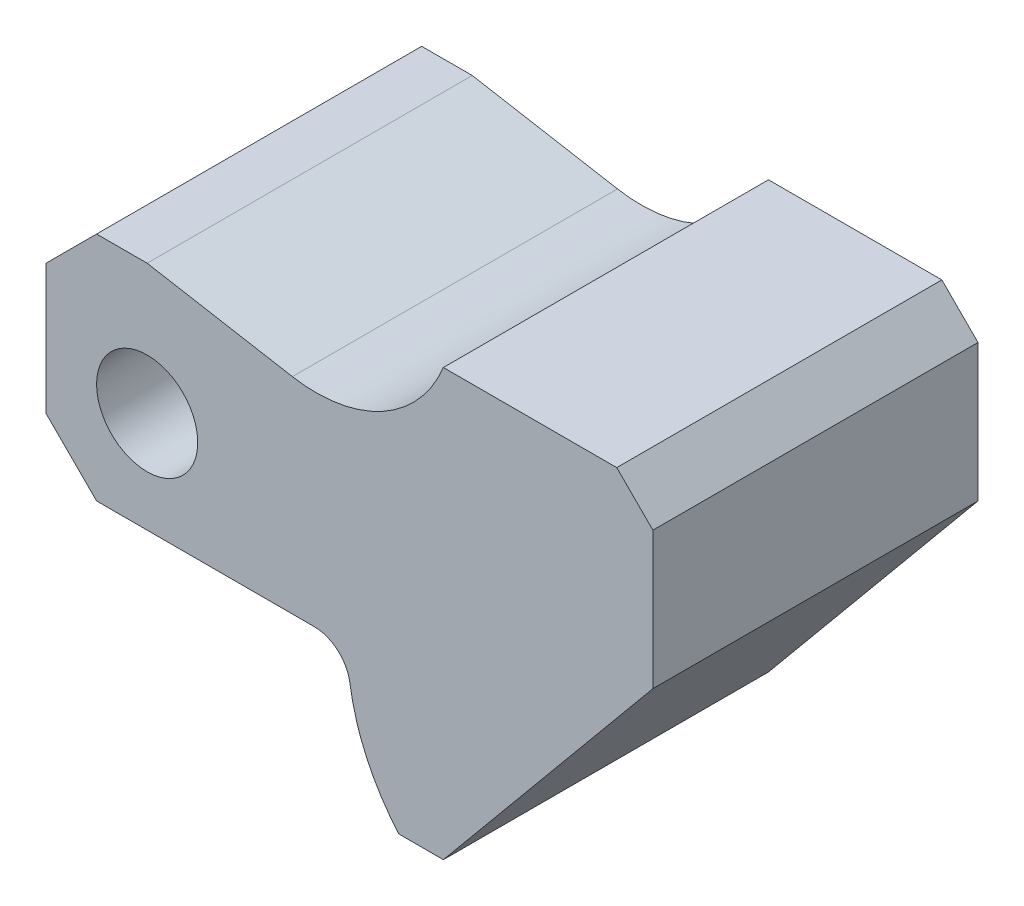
SolidWorks part; units mm, degrees
ref_plane "Front Plane" through (0, 0, 0) normal (0, 0, 1) x (1, 0, 0)
ref_plane "Top Plane" through (0, 0, 0) normal (0, 1, 0) x (1, 0, 0)
ref_plane "Right Plane" through (0, 0, 0) normal (1, 0, 0) x (0, 0, -1)
sketch "Esquisse1" plane through (0, 0, 0) normal (0, 0, 1) x (1, 0, 0)
  line L0 (-8.8823, 17.6898) -> (15.1177, 17.6898)
  line L1 (15.1177, 17.6898) -> (20.1177, 12.6898)
  line L2 (20.1177, 12.6898) -> (20.1177, -6.3102)
  line L3 (20.1177, -6.3102) -> (-8.8823, -41.3102)
  line L4 (-8.8823, -41.3102) -> (-15.0484, -41.3102)
  line L5 (-26.7698, -22.3102) -> (-56.8823, -22.3102)
  line L6 (-56.8823, -22.3102) -> (-63.8823, -15.3102)
  line L7 (-63.8823, -15.3102) -> (-63.8823, 2.6898)
  line L8 (-63.8823, 2.6898) -> (-56.8823, 9.6898)
  line L9 (-56.8823, 9.6898) -> (-49.8823, 9.6898)
  line L10 (-49.8823, 9.6898) -> (-29.7783, 6.1449)
  arc A0 (-15.0484, -41.3102) -> (-21.8242, -26.5749) centre (6.8605, -22.3102) cw
  arc A1 (-21.8242, -26.5749) -> (-26.7698, -22.3102) centre (-26.7698, -27.3102) ccw
  arc A2 (-29.7783, 6.1449) -> (-8.8823, 17.6898) centre (-26.479, 24.8562) ccw
  circle A3 centre (-49.8823, -8.3102) radius 7
  dimension "D5" = 29
  dimension "D15" = 5
  dimension "D19" = 19
  dimension "D20" = 14
  dimension "D1" = 29
  dimension "D2" = 135
  dimension "D3" = 5
  dimension "D4" = 24
  dimension "D6" = 19
  dimension "D7" = 29
  dimension "D8" = 84
  dimension "D9" = 7
  dimension "D10" = 32
  dimension "D11" = 135
  dimension "D12" = 7
  dimension "D13" = 14
  dimension "D14" = 190
  dimension "D16" = 59
  dimension "D17" = 14
  dimension "D18" = 14
  dimension "D21" = 19
  dimension "D22" = 135
extrude "Boss.-Extru.1" add sketch "Esquisse1" along normal blind 45
